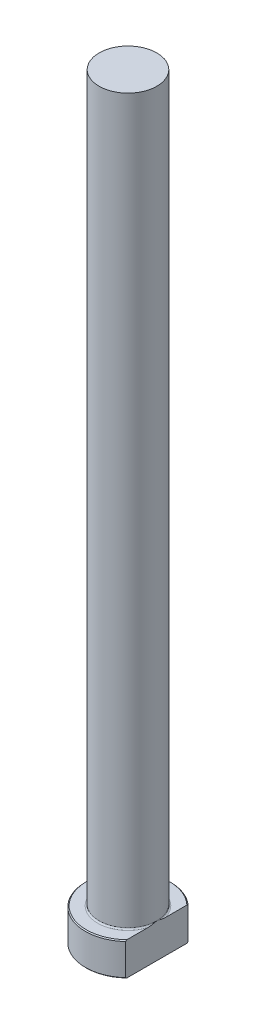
SolidWorks part; units mm, degrees
ref_plane "Front Plane" through (0, 0, 0) normal (0, 0, 1) x (1, 0, 0)
ref_plane "Top Plane" through (0, 0, 0) normal (0, 1, 0) x (1, 0, 0)
ref_plane "Right Plane" through (0, 0, 0) normal (1, 0, 0) x (0, 0, -1)
sketch "Sketch1" plane through (0, 0, 0) normal (0, 0, 1) x (1, 0, 0)
  line L0 (0, 259.9588) -> (0, -15.1925) construction
  line L1 (0, 0) -> (-9, 0)
  line L2 (-9, 0) -> (-9, 7)
  line L3 (-9, 7) -> (-6.1, 7)
  line L4 (-6.1, 7) -> (-6.1, 160)
  line L5 (-6.1, 160) -> (0, 160)
  line L6 (0, 160) -> (0, 0)
  dimension "L" = 160
  dimension "H" = 18
  dimension "T" = 7
  dimension "D" = 12.2
revolve "Revolve1" add sketch "Sketch1" angle 360 about L0
chamfer "Chamfer1" distance 0.2 angle 45 2 edges at (0, 7, 9) (0, 0, 9)
fillet "Fillet1" radius 0.3 1 edges at (0, 7, 6.1)
sketch "Sketch2" plane through (0, 0, 0) normal (0, 1, 0) x (1, 0, 0)
  line L0 (6.1, 6.6174) -> (6.1, -6.6174)
  circle A0 centre (0, 0) radius 9 construction
  arc A1 (6.1, -6.6174) -> (6.1, 6.6174) centre (0, 0) ccw
  circle A2 centre (0, 0) radius 6.1 construction
extrude "KEY" cut sketch "Sketch2" along normal through all
